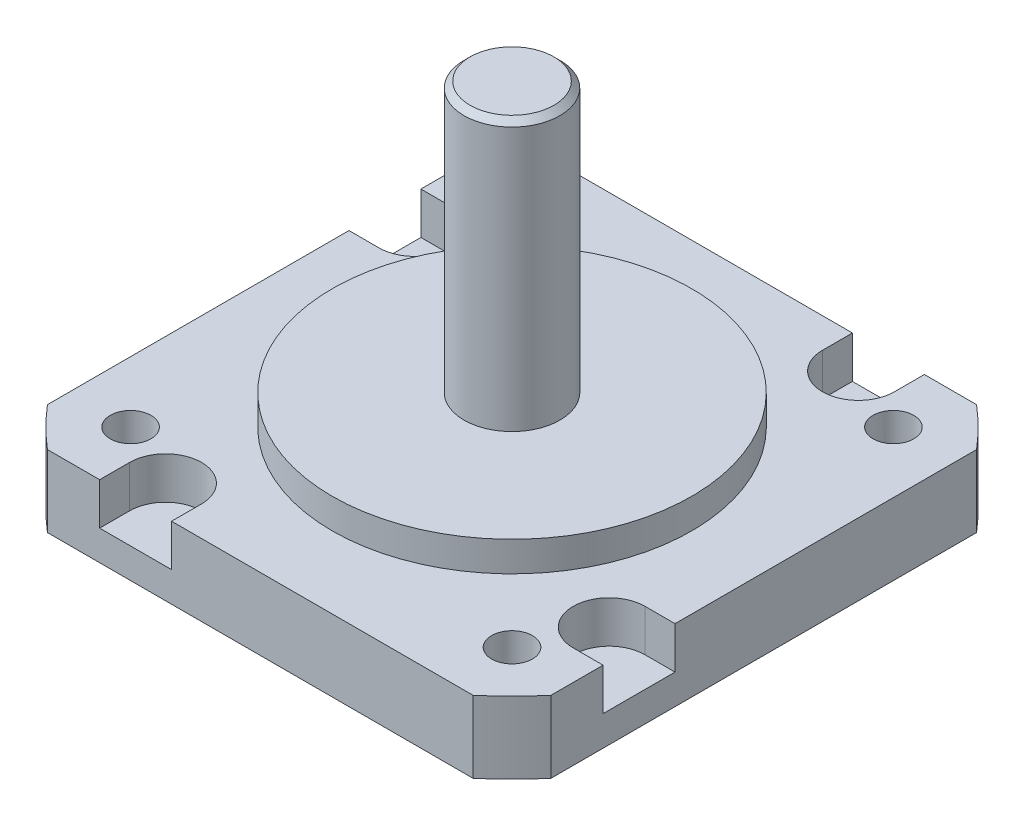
SolidWorks part; units mm, degrees
ref_plane "Front Plane" through (0, 0, 0) normal (0, 0, 1) x (1, 0, 0)
ref_plane "Top Plane" through (0, 0, 0) normal (0, 1, 0) x (1, 0, 0)
ref_plane "Right Plane" through (0, 0, 0) normal (1, 0, 0) x (0, 0, -1)
ref_plane "Plane3" through (0, 0, 0) normal (0, 0, -1) x (-1, 0, 0)
sketch "Sketch14" plane through (0, 0, 0) normal (0, 0, -1) x (-1, 0, 0)
  line L0 (-4, 7.5) -> (0, 7.5)
  line L1 (0, 7.5) -> (0, 38.5)
  line L2 (0, 38.5) -> (-3.4999, 38.5)
  line L3 (-3.4999, 38.5) -> (-4, 37.9999)
  line L4 (-4, 37.9999) -> (-4, 7.5)
  line L5 (0, 7.5) -> (0, 38.5) construction
revolve "Revolve2" add sketch "Sketch14" angle 360 about L1
ref_plane "Plane4" through (0, 13.5, 0) normal (0, 1, 0) x (-1, 0, 0)
sketch "Sketch19" plane through (0, 13.5, 0) normal (0, 1, 0) x (-1, 0, 0)
  line L0 (17.755, 21.0002) -> (-17.755, 21.0002)
  line L1 (-21.0002, 17.755) -> (-21.0002, -17.755)
  line L2 (-17.755, -21.0002) -> (17.755, -21.0002)
  line L3 (21.0002, -17.755) -> (21.0002, 17.755)
  arc A0 (-17.755, 21.0002) -> (-21.0002, 17.755) centre (0, 0) ccw
  arc A1 (-21.0002, -17.755) -> (-17.755, -21.0002) centre (0, 0) ccw
  arc A2 (17.755, -21.0002) -> (21.0002, -17.755) centre (0, 0) ccw
  arc A3 (21.0002, 17.755) -> (17.755, 21.0002) centre (0, 0) ccw
extrude "Boss-Extrude2" add sketch "Sketch19" against normal blind 6 separate body
sketch "Sketch25" plane through (0, 13.5, 0) normal (0, 1, 0) x (-1, 0, 0)
  line L0 (7.4, 21.0002) -> (7.4, 18.5002)
  line L1 (13.4, 18.5002) -> (13.4, 21.0002)
  line L2 (13.4, 21.0002) -> (7.4, 21.0002)
  arc A0 (7.4, 18.5002) -> (13.4, 18.5002) centre (10.4, 18.5002) ccw
extrude "Cut-Extrude5" cut sketch "Sketch25" against normal blind 3.5
sketch "Sketch31" plane through (0, 13.5, 0) normal (0, 1, 0) x (-1, 0, 0)
  line L0 (-21.0002, 7.4) -> (-18.5002, 7.4)
  line L1 (-18.5002, 13.4) -> (-21.0002, 13.4)
  line L2 (-21.0002, 13.4) -> (-21.0002, 7.4)
  arc A0 (-18.5002, 7.4) -> (-18.5002, 13.4) centre (-18.5002, 10.4) ccw
extrude "Cut-Extrude6" cut sketch "Sketch31" against normal blind 3.5
sketch "Sketch37" plane through (0, 13.5, 0) normal (0, 1, 0) x (-1, 0, 0)
  line L0 (-7.4, -21.0002) -> (-7.4, -18.5002)
  line L1 (-13.4, -18.5002) -> (-13.4, -21.0002)
  line L2 (-13.4, -21.0002) -> (-7.4, -21.0002)
  arc A0 (-7.4, -18.5002) -> (-13.4, -18.5002) centre (-10.4, -18.5002) ccw
extrude "Cut-Extrude7" cut sketch "Sketch37" against normal blind 3.5
sketch "Sketch43" plane through (0, 13.5, 0) normal (0, 1, 0) x (-1, 0, 0)
  line L0 (21.0002, -7.4) -> (18.5002, -7.4)
  line L1 (18.5002, -13.4) -> (21.0002, -13.4)
  line L2 (21.0002, -13.4) -> (21.0002, -7.4)
  arc A0 (18.5002, -7.4) -> (18.5002, -13.4) centre (18.5002, -10.4) ccw
extrude "Cut-Extrude8" cut sketch "Sketch43" against normal blind 3.5
sketch "Sketch48" plane through (0, 0, 0) normal (0, 0, -1) x (-1, 0, 0)
  line L0 (-15, 13.5) -> (0, 13.5)
  line L1 (0, 13.5) -> (0, 16)
  line L2 (0, 16) -> (-15, 16)
  line L3 (-15, 16) -> (-15, 13.5)
  line L4 (0, 13.5) -> (0, 16) construction
revolve "Revolve3" add sketch "Sketch48" angle 360 about L1
hole_wizard "Ø0.5 (0.5) Diameter Hole1" positions "Sketch50" profile "Sketch49" hole size "Ø0.5" standard "Ansi Metric"
sketch "Sketch50" plane through (0, 7.5, 0) normal (0, -1, 0) x (1, 0, 0)
  point P0 (0, 0)
sketch "Sketch49" plane through (0, 7.5, 0) normal (1, 0, 0) x (0, 0, -1)
  line L0 (0, 0) -> (0, 0.6502)
  line L1 (0, 0.6502) -> (0.25, 0.5)
  line L2 (0.25, 0.5) -> (0.25, 0)
  line L5 (0.25, 0) -> (0, 0)
  line L10 (0, 0.6502) -> (-0.25, 0.5) construction
  line L11 (0, -6.35) -> (0, 107.95) construction
  dimension "Hole Dia." = 0.5
  dimension "Hole Depth" = 0.5
  dimension "Drill Angle" = 118
hole_wizard "Ø3.4 (3.4) Diameter Hole2" positions "Sketch52" profile "Sketch51" hole size "Ø3.4" standard "Ansi Metric"
sketch "Sketch52" plane through (0, 7.5, 0) normal (0, -1, 0) x (1, 0, 0)
  point P0 (15.9099, -15.9099)
  point P1 (-15.9099, -15.9099)
  point P2 (-15.9099, 15.9099)
  point P3 (15.9099, 15.9099)
sketch "Sketch51" plane through (15.9099, 7.5, -15.9099) normal (1, 0, 0) x (0, 0, -1)
  line L0 (0, 0) -> (0, 31)
  line L1 (0, 31) -> (1.7, 31)
  line L2 (1.7, 31) -> (1.7, 0)
  line L5 (1.7, 0) -> (0, 0)
  line L11 (0, -6.35) -> (0, 107.95) construction
  dimension "Thru Hole Dia." = 3.4
  dimension "Thru Hole Depth" = 31
